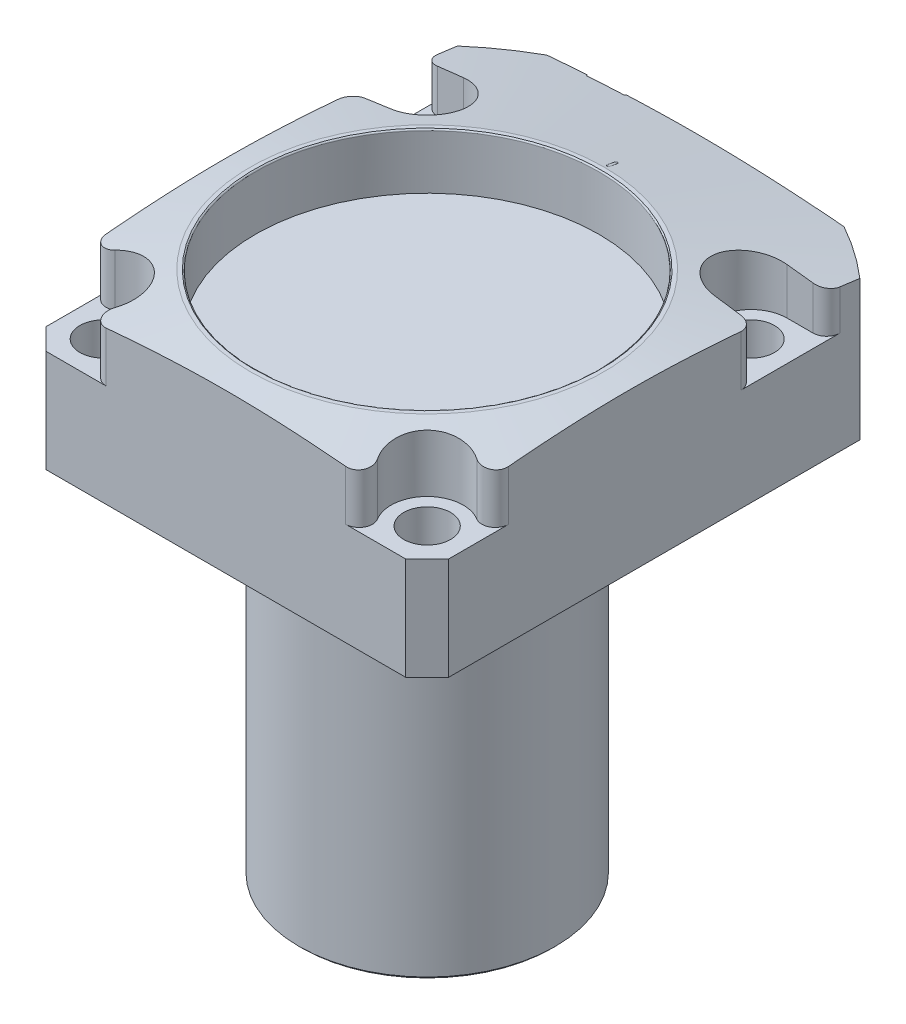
SolidWorks part; units mm, degrees
ref_plane "Front Plane" through (0, 0, 0) normal (0, 0, 1) x (1, 0, 0)
ref_plane "Top Plane" through (0, 0, 0) normal (0, 1, 0) x (1, 0, 0)
ref_plane "Right Plane" through (0, 0, 0) normal (1, 0, 0) x (0, 0, -1)
sketch "Sketch6" plane through (0, 0, 0) normal (0, 0, 1) x (1, 0, 0)
  line L0 (0, -8.9689) -> (0, 71.3762) construction
  line L1 (32.015, 30.3276) -> (33, 30.3276)
  line L2 (33, 30.3276) -> (57.15, 26.0693)
  line L3 (57.15, 26.0693) -> (57.15, 0)
  line L4 (57.15, 0) -> (23.885, 0)
  line L5 (23.885, 0) -> (23.885, -67.4878)
  line L6 (23.885, -67.4878) -> (0, -67.4878)
  line L7 (0, -67.4878) -> (0, 19.9898)
  line L8 (32.015, 30.3276) -> (32.015, 19.9898)
  line L9 (32.015, 19.9898) -> (0, 19.9898)
  dimension "D1" = 47.77
  dimension "D2" = 30.3276
  dimension "D3" = 67.4878
  dimension "D4" = 114.3
  dimension "D5" = 10
  dimension "D6" = 66
  dimension "D7" = 10.3378
  dimension "D8" = 64.03
  dimension "D9" = 97.8154
revolve "Revolve3" add sketch "Sketch6" angle 360 about L0
fillet "Fillet7" radius 0.25 1 edges at (0, 30.3276, -32.015)
sketch "Sketch7" plane through (0, 0, 0) normal (0, -1, 0) x (1, 0, 0)
  line L0 (0, 0) -> (0, -52.3237) construction
  line L1 (-37.5, 37.5) -> (37.5, 37.5)
  line L2 (-37.5, 37.5) -> (-37.5, -50)
  line L3 (-37.5, -50) -> (37.5, -50)
  line L4 (37.5, 37.5) -> (37.5, -50)
  dimension "D1" = 75
  dimension "D2" = 87.5
  dimension "D3" = 37.5
  dimension "D4" = 50
  dimension "D5" = 37.5
extrude "Cut-Extrude5" cut sketch "Sketch7" against normal through all flip side to cut
sketch "Sketch8" plane through (0, 0, 0) normal (0, -1, 0) x (1, 0, 0)
  circle A0 centre (-30.1752, 30.1752) radius 4.3688
  dimension "D1" = 8.7376
  dimension "D2" = 30.1752
  dimension "D3" = 30.1752
extrude "Cut-Extrude6" cut sketch "Sketch8" against normal through all
pattern_circular "CirPattern2" count 4 over 360 about axis through (0, 0, 0) along (0, 1, 0) of "Cut-Extrude6"
chamfer "Chamfer1" distance 4 angle 45 2 edges at (-37.5, 13.3976, 37.5) (37.5, 13.3976, 37.5)
sketch "Sketch9" plane through (0, 30.3276, 0) normal (0, 1, 0) x (1, 0, 0)
  line L0 (-37.5, -33.5) -> (-33.5, -37.5) construction
  line L1 (-33.5, -37.5) -> (33.5, -37.5) construction
  line L2 (37.5, 36.9062) -> (37.5, 23.4442)
  line L3 (-37.5, -33.5) -> (-33.5, -37.5)
  line L4 (37.5, 23.4442) -> (30.1752, 23.4442)
  line L5 (30.1752, 36.9062) -> (37.5, 36.9062)
  line L6 (-30.1752, 36.9062) -> (-37.5, 36.9062)
  line L7 (-37.5, 43.1262) -> (-37.5, -33.5) construction
  line L8 (-37.5, 23.4442) -> (-30.1752, 23.4442)
  line L9 (-37.5, 36.9062) -> (-37.5, 23.4442)
  line L10 (-33.5, -37.5) -> (-27.9809, -37.5)
  line L11 (0, 0) -> (0, 26.6366) construction
  line L13 (-37.5, -27.9809) -> (-34.9347, -25.4157)
  line L14 (-25.4157, -34.9347) -> (-27.9809, -37.5)
  line L15 (-37.5, -27.9809) -> (-37.5, -33.5)
  line L16 (37.5, -27.9809) -> (37.5, -33.5)
  line L17 (25.4157, -34.9347) -> (27.9809, -37.5)
  line L18 (37.5, -27.9809) -> (34.9347, -25.4157)
  line L19 (33.5, -37.5) -> (27.9809, -37.5)
  line L20 (37.5, -33.5) -> (33.5, -37.5)
  arc A0 (-25.4157, -34.9347) -> (-34.9347, -25.4157) centre (-30.1752, -30.1752) ccw
  arc A1 (-30.1752, 23.4442) -> (-30.1752, 36.9062) centre (-30.1752, 30.1752) ccw
  arc A2 (25.4157, -34.9347) -> (34.9347, -25.4157) centre (30.1752, -30.1752) cw
  arc A3 (30.1752, 23.4442) -> (30.1752, 36.9062) centre (30.1752, 30.1752) cw
  dimension "D1" = 13.462
extrude "Cut-Extrude7" cut sketch "Sketch9" against normal offset from surface (11.2268 mm away) 19.1008
fillet "Fillet4" radius 2.5 8 edges at (-37.5, 23.7245, -23.4442) (37.5, 22.9849, -36.9062) (37.5, 23.7245, -23.4442) (37.5, 23.4985, 27.9809) (27.9809, 23.4985, 37.5) (-27.9809, 23.4985, 37.5) (-37.5, 23.4985, 27.9809) (-37.5, 22.9849, -36.9062)
fillet "Fillet5" radius 0.4 1 edges at (0, 0, -23.885)
chamfer "Chamfer2" distance 0.5 angle 45 1 edges at (0, -67.4878, -23.885)
ref_plane "Plane1" through (0, 17.018, 0) normal (0, -1, 0) x (1, 0, 0)
sketch "Sketch11" plane through (0, 17.018, 0) normal (0, -1, 0) x (1, 0, 0)
  line L0 (-16, -4.7006) -> (-16, -58.3255) construction
  line L1 (-27.6789, -50) -> (27.6789, -50) construction
  line L2 (-22.1849, -49.75) -> (-21.6396, -47.1846)
  line L3 (-21.6396, -47.1846) -> (-20.9784, -46.5234)
  line L10 (-16, -50) -> (-26.4775, -50)
  line L11 (-16, -35.018) -> (-16, -50)
  line L12 (-20.9784, -35.018) -> (-16, -35.018)
  line L13 (-20.9784, -46.5234) -> (-20.9784, -35.018)
  line L15 (-26.4775, -49.75) -> (-22.1849, -49.75)
  line L16 (-26.4775, -50) -> (-26.4775, -49.75)
  dimension "D1" = 16
  dimension "D2" = 0.25
  dimension "D3" = 14.732
  dimension "D4" = 9.9568
  dimension "D5" = 20.955
  dimension "D6" = 12
  dimension "D7" = 12.3698
  dimension "D8" = 45
  dimension "D9" = 2.5654
revolve "Cut-Revolve5" cut sketch "Sketch11" angle 360 about L0
ref_plane "Plane2" through (0, 0, -41.7576) normal (0, 0, 1) x (1, 0, 0)
sketch "Sketch13" plane through (0, 0, -41.7576) normal (0, 0, 1) x (1, 0, 0)
  line L0 (-19.4544, 17.7546) -> (-19.4544, 5.5009)
  line L1 (-20.572, 2.7432) -> (-20.1293, 4.826)
  line L2 (-20.572, 2.7432) -> (-21.6261, 2.7432)
  line L3 (-21.6261, 2.7432) -> (-21.6261, 0)
  line L4 (-24.285, 0) -> (24.285, 0) construction
  line L5 (-21.6261, 0) -> (-16, 0)
  line L6 (-16, 0) -> (-16, 17.7546)
  line L7 (-16, 17.7546) -> (-19.4544, 17.7546)
  line L8 (-16, 13.0098) -> (-16, -4.3918) construction
  line L9 (-20.1293, 4.826) -> (-19.4544, 5.5009)
  line L10 (-20.572, 2.7432) -> (-16, 2.7432) construction
  dimension "D1" = 16
  dimension "D2" = 6.9088
  dimension "D3" = 15.0114
  dimension "D4" = 2.7432
  dimension "D5" = 11.2522
  dimension "D6" = 45
  dimension "D7" = 2.0828
  dimension "D8" = 12
  dimension "D9" = 9.144
revolve "Cut-Revolve6" cut sketch "Sketch13" angle 360 about L8
sketch "Sketch1" plane through (-3.5242, 5.6324, -41.7576) normal (0, 0, 1) x (1, 0, 0)
  line L0 (-12.4758, 0) -> (-12.4758, 50000) construction
  line L1 (-10.8883, 2.521) -> (-8.6023, 2.521)
  line L2 (-8.6023, 2.521) -> (-8.6023, -0.3754)
  line L3 (-8.5642, -2.8892) -> (50000, -2.8892) construction
  line L4 (-9.4786, -1.289) -> (-9.4786, -1.9748)
  line L5 (-8.5642, -2.8892) -> (-7.0148, -2.8892)
  line L6 (-7.0148, -2.8892) -> (-7.0148, -4.3116)
  line L7 (-7.0148, -4.3116) -> (-7.6928, -4.3116)
  line L8 (-9.8088, -4.3116) -> (-9.8088, -5.4292)
  line L9 (-9.8088, -5.4292) -> (-10.8883, -5.4292)
  line L10 (-10.8883, -5.4292) -> (-10.8883, 2.521)
  line L11 (-1000, -2.8892) -> (-10.8883, -2.8892) construction
  line L12 (-8.1147, -4.3116) -> (-9.8088, -4.3116)
  arc A0 (-8.6023, -0.3754) -> (-9.4786, -1.289) centre (-8.5642, -1.289) ccw
  arc A1 (-9.4786, -1.9748) -> (-8.5642, -2.8892) centre (-8.5642, -1.9748) ccw
  arc A2 (-8.1147, -4.3116) -> (-7.6928, -4.3116) centre (-7.9038, -5.1752) ccw
  dimension "D8" = 1.6002
  dimension "D9" = 0.9144
  dimension "D10" = 7.9502
  dimension "D11" = 1.778
  dimension "D1" = 7.747
  dimension "D2" = 5.9944
  dimension "D3" = 10.922
  dimension "D4" = 5.334
  dimension "D5" = 3.175
  dimension "D6" = 1.4224
  dimension "D7" = 2.54
  dimension "D12" = 0.8636
revolve "Revolve1" add sketch "Sketch1" angle 360 about L0
sketch "Sketch2" plane through (-16, 0.2032, -41.7576) normal (0, -1, 0) x (0, 0, 1)
  line L0 (0, 0) -> (0, 50000) construction
  line L1 (0, 1.8331) -> (1.5875, 0.9165)
  line L2 (1.5875, 0.9165) -> (1.5875, -0.9165)
  line L3 (1.5875, -0.9165) -> (0, -1.8331)
  line L4 (0, -1.8331) -> (-1.5875, -0.9165)
  line L5 (-1.5875, -0.9165) -> (-1.5875, 0.9165)
  line L6 (-1.5875, 0.9165) -> (0, 1.8331)
  circle A0 centre (0, 0) radius 1.5875 construction
  dimension "D1" = 3.175
extrude "Cut-Extrude1" cut sketch "Sketch2" against normal up to surface (7.9502 mm away)
other "PORT_ADTAPTER<1>"
sketch "Sketch17" plane through (0, 0, 0) normal (1, 0, 0) x (0, 0, -1)
  line L0 (33.1793, 31.0677) -> (36.0752, 30.5571) construction
  line L1 (33.4924, 30.2408) -> (35.462, 29.8935) construction
  line L2 (50, 27.33) -> (33, 30.3276) construction
  line L3 (33.8704, 30.9459) -> (35.348, 30.6853) construction
  line L5 (33.7315, 30.158) -> (35.2091, 29.8975)
  line L6 (33.0825, 31.0848) -> (36.1358, 30.5464)
  arc A0 (33.0825, 31.0848) -> (33.7315, 30.158) centre (33.8704, 30.9459) ccw
  arc A1 (35.2091, 29.8975) -> (36.1358, 30.5464) centre (35.348, 30.6853) ccw
  dimension "D2" = 1.6
  dimension "D1" = 0.76
  dimension "D3" = 2
  dimension "D4" = 0.5
revolve "Cut-Revolve7" cut sketch "Sketch17" angle 360 about L0
